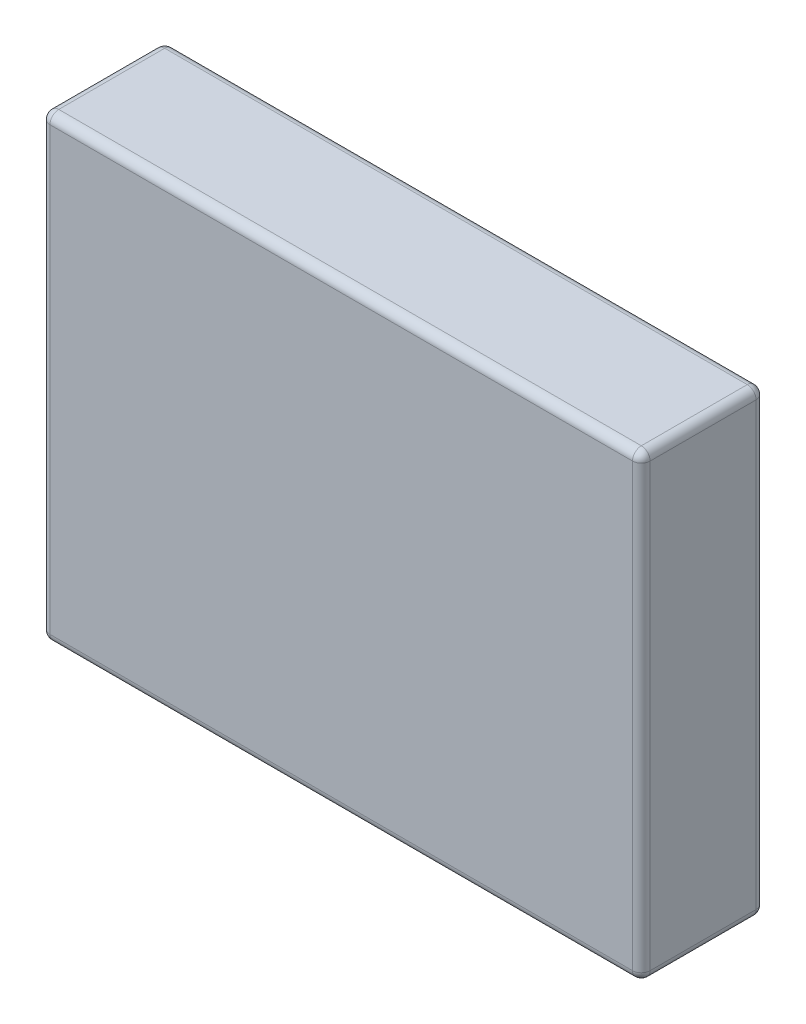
SolidWorks part; units mm, degrees
ref_plane "Face" through (0, 0, 0) normal (0, 0, 1) x (1, 0, 0)
ref_plane "Dessus" through (0, 0, 0) normal (0, 1, 0) x (1, 0, 0)
ref_plane "Droite" through (0, 0, 0) normal (1, 0, 0) x (0, 0, -1)
sketch "Esquisse1" plane through (0, 0, 0) normal (0, 0, 1) x (1, 0, 0)
  line L1 (0, 0) -> (340, 0)
  line L2 (0, 0) -> (0, -260)
  line L3 (0, -260) -> (340, -260)
  line L4 (340, 0) -> (340, -260)
  dimension "D1" = 340
  dimension "D2" = 260
extrude "Base-Extrusion" add sketch "Esquisse1" along normal blind 70
fillet "Congé1" radius 5
